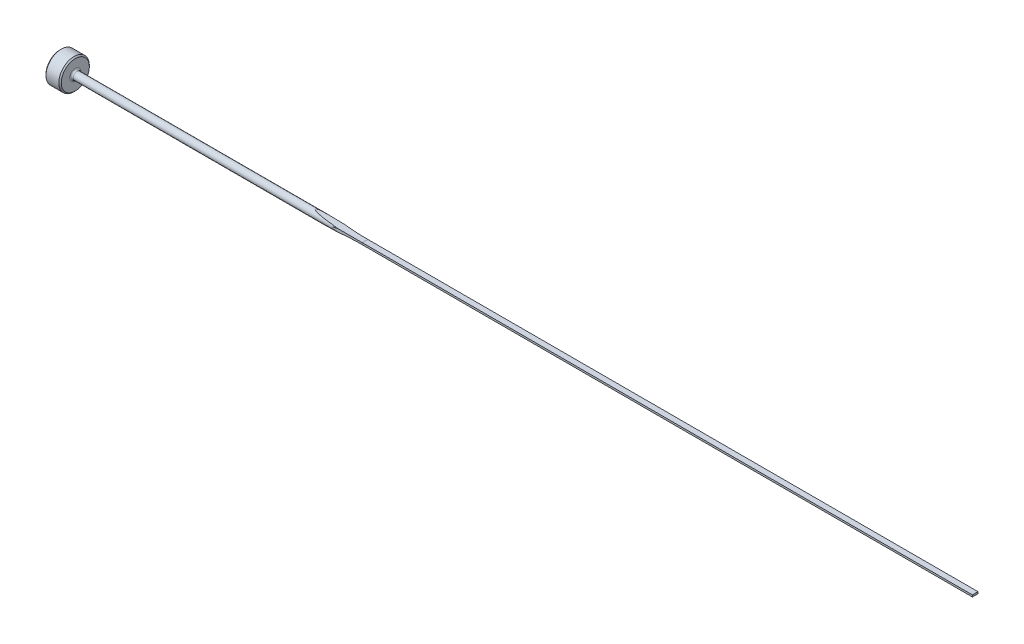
SolidWorks part; units mm, degrees
ref_plane "Front Plane" through (0, 0, 0) normal (0, 0, 1) x (1, 0, 0)
ref_plane "Top Plane" through (0, 0, 0) normal (0, 1, 0) x (1, 0, 0)
ref_plane "Right Plane" through (0, 0, 0) normal (1, 0, 0) x (0, 0, -1)
sketch "Sketch1" plane through (0, 0, 0) normal (0, 0, 1) x (1, 0, 0)
  line L0 (0, 0) -> (167.7268, 0) construction
  line L1 (0, 0) -> (0, 3.175)
  line L2 (0, 3.175) -> (3.175, 3.175)
  line L3 (3.175, 3.175) -> (3.175, 0.7938)
  line L4 (3.175, 0.7938) -> (190.5, 0.7937)
  line L5 (190.5, 0.7937) -> (190.5, 0)
  line L6 (190.5, 0) -> (0, 0)
  dimension "D1" = 190.5
  dimension "D2" = 6.35
  dimension "D3" = 1.5875
  dimension "D4" = 3.175
revolve "Revolve1" add sketch "Sketch1" angle 360 about L0
sketch "Sketch2" plane through (0, 0, 0) normal (0, 0, 1) x (1, 0, 0)
  line L0 (190.5, 0.7938) -> (190.5, 0.1905)
  line L1 (190.5, -0.7937) -> (190.5, 0.7937) construction
  line L2 (190.5, 0.1905) -> (63.5, 0.1905)
  line L3 (190.5, 0.7938) -> (3.175, 0.7938) construction
  line L4 (53.161, 0.7937) -> (190.5, 0.7938)
  line L5 (166.0833, 0) -> (153.1705, 0) construction
  arc A0 (63.5, 0.1905) -> (53.161, 0.7937) centre (63.5, 89.0905) cw
  dimension "D1" = 88.9
  dimension "D3" = 127
  dimension "D2" = 0.381
  dimension "D4" = 10.339
extrude "Cut-Extrude1" cut sketch "Sketch2" against normal through all both and the other way through all
mirror "Mirror1" about plane through (0, 0, 0) normal (0, 1, 0) of "Cut-Extrude1"
sketch "Sketch3" plane through (0, 0, 0) normal (0, 1, 0) x (1, 0, 0)
  line L0 (190.5, 0.7938) -> (190.5, 0.5842)
  line L1 (190.5, 0.7706) -> (190.5, -0.7706) construction
  line L2 (190.5, 0.5842) -> (63.5, 0.5842)
  line L3 (190.5, 0.7938) -> (3.175, 0.7938) construction
  line L4 (57.3997, 0.7937) -> (190.5, 0.7938)
  line L5 (163.4716, 0) -> (166.2513, 0) construction
  line L6 (63.5, 0.7706) -> (63.5, -0.7706) construction
  arc A0 (63.5, 0.5842) -> (57.3997, 0.7937) centre (63.5, 89.4842) cw
  dimension "D2" = 88.9
  dimension "D1" = 1.1684
extrude "Cut-Extrude2" cut sketch "Sketch3" against normal through all both and the other way through all
mirror "Mirror2" about plane through (0, 0, 0) normal (0, 0, 1) of "Cut-Extrude2"
fillet "Fillet1" radius 0.381 1 edges at (3.175, 0, 0.7938)
chamfer "Chamfer1" distance 0.254 angle 45 2 edges at (0, 0, 3.175) (3.175, 0, 3.175)
